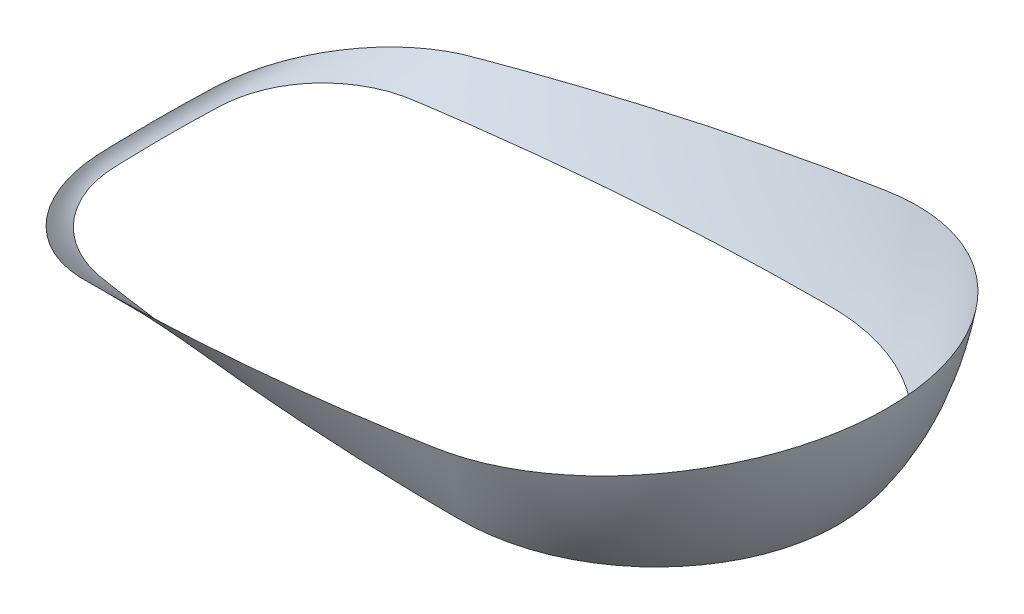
SolidWorks part; units mm, degrees
ref_plane "Front Plane" through (0, 0, 0) normal (0, 0, 1) x (1, 0, 0)
ref_plane "Top Plane" through (0, 0, 0) normal (0, 1, 0) x (1, 0, 0)
ref_plane "Right Plane" through (0, 0, 0) normal (1, 0, 0) x (0, 0, -1)
sketch "Sketch1" plane through (0, 0, 0) normal (0, 1, 0) x (1, 0, 0)
  line L0 (-50.8, 6.985) -> (-50.8, -6.985) construction
  line L1 (0, 0) -> (-50.8, 0) construction
  line L2 (36.83, 19.4888) -> (36.83, -19.4888) construction
  line L3 (0, 0) -> (36.83, 0) construction
  line L4 (11.7625, 24.13) -> (11.7625, -24.13) construction
  line L5 (33.9033, 11.1777) -> (33.9033, -11.1777) construction
  line L6 (-59.69, 18.1964) -> (-59.69, -27.8736) construction
  line L7 (-114.3, 22.3017) -> (-114.3, -30.0402) construction
  line L8 (-50.8, 0) -> (-50.9434, 0) construction
  arc A0 (-50.8, 6.985) -> (-50.8, -6.985) centre (119.2366, 0) ccw
  arc A1 (11.7625, 24.13) -> (33.9033, 11.1777) centre (11.7625, -1.27) cw
  arc A2 (11.7625, 24.13) -> (-38.9838, 20.2164) centre (11.7625, -306.8328) ccw
  arc A3 (-38.9838, 20.2164) -> (-50.8, 6.985) centre (-36.8418, 6.4116) ccw
  arc A4 (11.7625, -24.13) -> (-38.9838, -20.2164) centre (11.7625, 306.8328) cw
  arc A5 (-38.9838, -20.2164) -> (-50.8, -6.985) centre (-36.8418, -6.4116) cw
  arc A6 (33.9033, 11.1777) -> (33.9033, -11.1777) centre (14.0215, 0) cw
  arc A7 (33.9033, -11.1777) -> (11.7625, -24.13) centre (11.7625, 1.27) cw
  point P11 (11.7625, 0)
  dimension "D3" = 25.4
  dimension "D5" = 59.69
  dimension "D7" = 13.97
  dimension "D8" = 170.18
  dimension "D1" = 87.63
  dimension "D2" = 50.8
  dimension "D4" = 48.26
  dimension "D6" = 114.3
  dimension "D9" = 22.3554
  dimension "D10" = 13.97
sketch "Sketch7" plane through (0, 0, 0) normal (0, 0, 1) x (1, 0, 0)
  line L0 (447.3954, 686.9683) -> (2479.3954, 686.9683) construction
ref_plane "Plane1" through (-1.4607, 9.2226, 0) normal (-0.1564, 0.9877, 0) x (0, 0, 1)
ref_plane "Plane2" through (-7.6566, 28.575, 0) normal (-0.2588, 0.9659, 0) x (0, 0, 1)
sketch "Sketch2" plane through (-1.4607, 9.2226, 0) normal (-0.1564, 0.9877, 0) x (0, 0, 1)
  line L0 (0, 0) -> (0, 45.1605) construction
  line L1 (0, 0) -> (0, -51.4395) construction
  arc A1 (-7.1903, -51.2941) -> (7.1903, -51.2941) centre (0, 126.4436) ccw
  spline S7 degree 3 poles (-13.6384, 41.6425) (-14.8157, 40.9906) (-15.9376, 40.2685) (-18.0738, 38.6883) (-19.0882, 37.8303) (-21.0076, 35.9758) (-21.9163, 34.973) (-23.5716, 32.8822) (-24.3246, 31.7892) (-25.6828, 29.509) (-26.2879, 28.3217) (-27.0798, 26.4671) (-27.3225, 25.8408) (-27.7629, 24.5808) (-27.9612, 23.9458) (-28.4911, 22.0257) (-28.7581, 20.7258) (-29.0278, 18.7459) (-29.0959, 18.0809) (-29.1871, 16.7406) (-29.21, 16.0669) (-29.21, 15.3938) knots 0 0 0 0 0.125 0.125 0.25 0.25 0.375 0.375 0.5 0.5 0.625 0.625 0.6875 0.6875 0.75 0.75 0.875 0.875 0.9375 0.9375 1 1 1 1
  spline S8 degree 3 poles (13.6384, 41.6425) (11.5424, 42.803) (9.3409, 43.676) (6.4609, 44.4176) (5.8771, 44.5485) (4.7022, 44.7726) (4.1142, 44.8654) (2.3486, 45.0876) (1.1692, 45.161) (-1.1938, 45.16) (-2.3776, 45.0856) (-4.1566, 44.8593) (-4.7476, 44.7648) (-5.9143, 44.5404) (-6.4916, 44.4103) (-9.3489, 43.6716) (-11.5423, 42.803) (-13.6384, 41.6425) knots 0 0 0 0 0.25 0.25 0.3125 0.3125 0.375 0.375 0.5 0.5 0.625 0.625 0.6875 0.6875 0.75 0.75 1 1 1 1
  spline S9 degree 3 poles (29.21, 15.3938) (29.21, 16.7397) (29.119, 18.0702) (28.7623, 20.7017) (28.4966, 22.0027) (27.7884, 24.5747) (27.342, 25.8523) (26.2952, 28.3053) (25.6936, 29.4888) (24.3364, 31.7713) (23.5809, 32.8703) (21.9105, 34.9806) (21.0143, 35.9682) (19.1055, 37.8145) (18.0929, 38.6731) (15.9502, 40.2602) (14.8155, 40.9908) (13.6384, 41.6425) knots 0 0 0 0 0.125 0.125 0.25 0.25 0.375 0.375 0.5 0.5 0.625 0.625 0.75 0.75 0.875 0.875 1 1 1 1
  spline S10 degree 3 poles (25.2345, -35.3722) (26.5594, -26.963) (27.5518, -18.5279) (28.8771, -1.6059) (29.21, 6.8809) (29.21, 15.3938) knots 0 0 0 0 0.5 0.5 1 1 1 1
  spline S11 degree 3 poles (7.1903, -51.2941) (8.2862, -51.2497) (9.3625, -51.1132) (11.4777, -50.663) (12.5173, -50.3491) (14.5541, -49.537) (15.5233, -49.0501) (17.367, -47.9205) (18.2426, -47.2768) (19.8894, -45.8297) (20.6387, -45.0458) (21.6555, -43.7826) (21.9765, -43.3469) (22.5819, -42.4457) (22.867, -41.979) (23.6612, -40.5406) (24.0995, -39.5499) (24.8008, -37.5076) (25.0638, -36.4559) (25.2345, -35.3722) knots 0 0 0 0 0.125 0.125 0.25 0.25 0.375 0.375 0.5 0.5 0.625 0.625 0.6875 0.6875 0.75 0.75 0.875 0.875 1 1 1 1
  spline S12 degree 3 poles (-25.2345, -35.3722) (-25.0637, -36.456) (-24.8006, -37.5086) (-24.2736, -39.0428) (-24.0757, -39.5467) (-23.6351, -40.5394) (-23.3916, -41.0296) (-22.5967, -42.4673) (-21.9909, -43.3665) (-20.9729, -44.6302) (-20.6153, -45.0372) (-19.863, -45.8222) (-19.4664, -46.2019) (-18.2337, -47.2836) (-17.3604, -47.9251) (-15.9761, -48.7724) (-15.5022, -49.0355) (-14.529, -49.5227) (-14.0271, -49.7476) (-12.5059, -50.3526) (-11.471, -50.6647) (-9.3612, -51.1132) (-8.2862, -51.2497) (-7.1903, -51.2941) knots 0 0 0 0 0.125 0.125 0.1875 0.1875 0.25 0.25 0.375 0.375 0.4375 0.4375 0.5 0.5 0.625 0.625 0.6875 0.6875 0.75 0.75 0.875 0.875 1 1 1 1
  spline S13 degree 3 poles (-29.21, 15.3938) (-29.21, 6.8809) (-28.8771, -1.6059) (-27.5518, -18.5279) (-26.5594, -26.963) (-25.2345, -35.3722) knots 0 0 0 0 0.5 0.5 1 1 1 1
sketch "Sketch3" plane through (0, 0, 0) normal (0, 0, 1) x (1, 0, 0)
  arc A0 (36.83, 0) -> (43.1438, 16.2873) centre (10.4253, 19.6032) ccw
sketch "Sketch6" plane through (0, 0, 0) normal (0, 0, 1) x (1, 0, 0)
  arc A0 (-50.9434, 0) -> (-52.2669, 1.1757) centre (-50.2491, 2.1143) cw
surface "Surface-Loft1"
